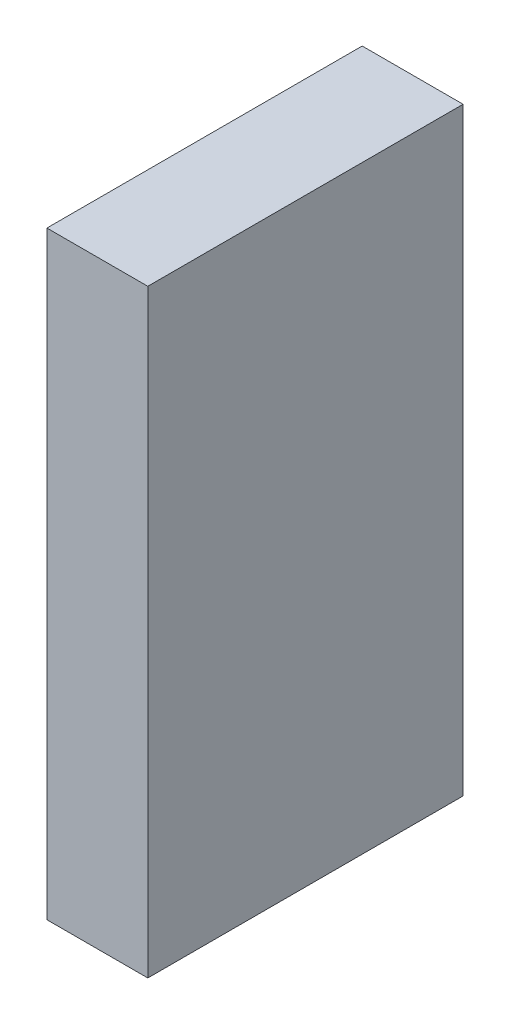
SolidWorks part; units mm, degrees
ref_plane "Face" through (0, 0, 0) normal (0, 0, 1) x (1, 0, 0)
ref_plane "Dessus" through (0, 0, 0) normal (0, 1, 0) x (1, 0, 0)
ref_plane "Droite" through (0, 0, 0) normal (1, 0, 0) x (0, 0, -1)
sketch "Esquisse1" plane through (0, 0, 0) normal (0, 0, 1) x (1, 0, 0)
  line L1 (0, 0) -> (8, 0)
  line L2 (0, 0) -> (0, 47.5)
  line L3 (0, 47.5) -> (8, 47.5)
  line L4 (8, 0) -> (8, 47.5)
  dimension "D1" = 47.5
  dimension "D2" = 8
extrude "Extrusion1" add sketch "Esquisse1" along normal blind 25
